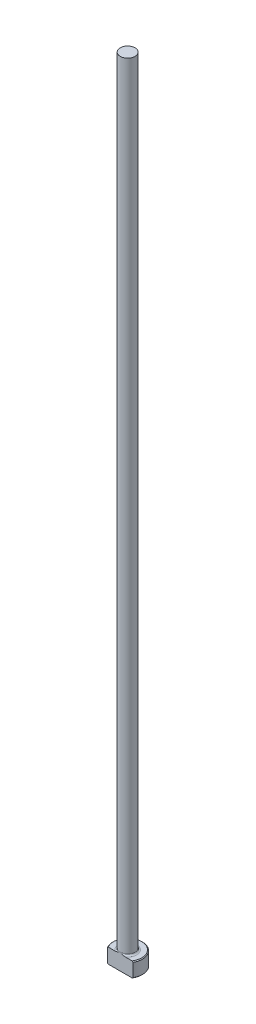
SolidWorks part; units mm, degrees
ref_plane "Front Plane" through (0, 0, 0) normal (0, 0, 1) x (1, 0, 0)
ref_plane "Top Plane" through (0, 0, 0) normal (0, 1, 0) x (1, 0, 0)
ref_plane "Right Plane" through (0, 0, 0) normal (1, 0, 0) x (0, 0, -1)
sketch "Sketch1" plane through (0, 0, 0) normal (0, 0, 1) x (1, 0, 0)
  line L0 (0, 259.9588) -> (0, -15.1925) construction
  line L1 (0, 0) -> (-4.7625, 0)
  line L2 (-4.7625, 0) -> (-4.7625, 4.7498)
  line L3 (-4.7625, 4.7498) -> (-2.3812, 4.7498)
  line L4 (-2.3812, 4.7498) -> (-2.3812, 254)
  line L5 (-2.3812, 254) -> (0, 254)
  line L6 (0, 254) -> (0, 0)
  dimension "L" = 254
  dimension "H" = 9.525
  dimension "T" = 4.7498
  dimension "D" = 4.7625
revolve "Revolve1" add sketch "Sketch1" angle 360 about L0
chamfer "Chamfer1" distance 0.254 angle 45 2 edges at (0, 4.7498, 4.7625) (0, 0, 4.7625)
fillet "Fillet1" radius 0.508 1 edges at (0, 4.7498, 2.3812)
sketch "Sketch2" plane through (0, 0, 0) normal (0, 1, 0) x (1, 0, 0)
  line L0 (-4.1244, -2.3812) -> (4.1244, -2.3812)
  circle A0 centre (0, 0) radius 4.7625 construction
  arc A1 (-4.1244, -2.3812) -> (4.1244, -2.3812) centre (0, 0) ccw
  circle A3 centre (0, 0) radius 2.3812 construction
  dimension "D1" = 0
extrude "Key" cut sketch "Sketch2" along normal through all
sketch "Pocket Sketch" plane through (0, 0, 0) normal (0, 0, 1) x (1, 0, 0)
  line L0 (-5.1594, 0) -> (-5.1594, 4.7752)
  line L1 (-5.1594, 4.7752) -> (-3.3417, 4.7752)
  line L2 (-2.5797, 5.5372) -> (-2.5797, 22.225)
  line L3 (-2.5797, 22.225) -> (0, 22.225)
  line L4 (0, 22.225) -> (0, 0)
  line L5 (0, 0) -> (-5.1594, 0)
  line L6 (0, 12.6104) -> (0, -2.4989) construction
  line L7 (-4.7625, 4.4958) -> (-4.7625, 0.254) construction
  line L8 (4.5085, 4.7498) -> (-4.5085, 4.7498) construction
  line L9 (-2.3812, 254) -> (-2.3812, 5.2578) construction
  line L10 (-3.3417, 4.7752) -> (-2.5797, 5.5372)
  point P3 (-2.5797, 4.7752)
  dimension "D1" = 10.3187
  dimension "D2" = 0.3969
  dimension "D3" = 0.0254
  dimension "D4" = 0.1984
  dimension "D5" = 5.1594
  dimension "D6" = 22.225
